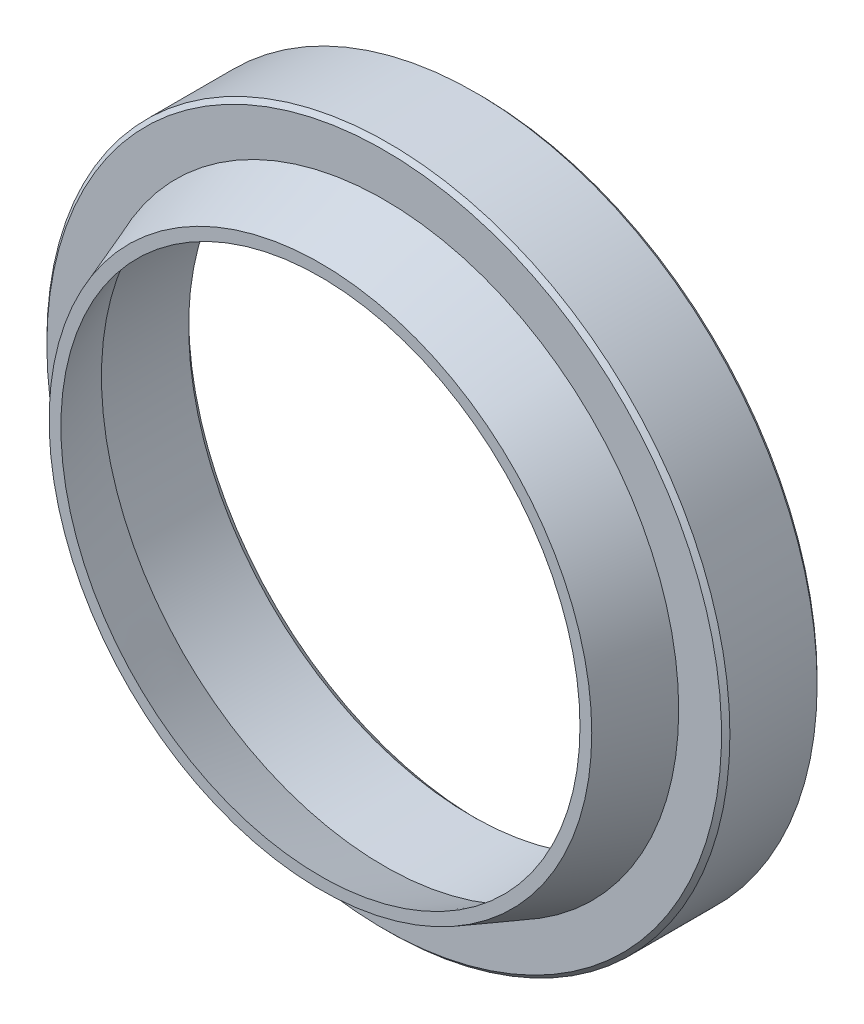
SolidWorks part; units mm, degrees
ref_plane "Front" through (0, 0, 0) normal (0, 0, 1) x (1, 0, 0)
ref_plane "Top" through (0, 0, 0) normal (0, 1, 0) x (1, 0, 0)
ref_plane "Right" through (0, 0, 0) normal (1, 0, 0) x (0, 0, -1)
sketch "Sketch1" plane through (25, 0, -4.5162) normal (0, 1, 0) x (-1, 0, 0)
  line L0 (25, 9.1959) -> (25, -4.6797) construction
  line L1 (45.7, -7.1505) -> (45.7, -0.1545)
  line L2 (45.7, -7.1505) -> (50, -7.1505)
  line L3 (45.7, -0.1545) -> (44, 4.5162)
  line L4 (46.56, -0.1505) -> (50, -0.1505)
  line L5 (50, -7.1505) -> (50, -0.1505)
  line L6 (44, 4.5162) -> (44.8615, 4.5162)
  line L7 (44.8615, 4.5162) -> (46.56, -0.1505)
  dimension "D1" = 38
  dimension "h" = 7
  dimension "D" = 50
  dimension "S" = 4.3
  dimension "D5" = 160
  dimension "D6" = 0.86
  dimension "D7" = 4.6667
revolve "Body" add sketch "Sketch1" angle 360 about L0
chamfer "EndChamfer" distance 0.6143 angle 45 1 edges at (20.7, 0, -11.6667)
chamfer "BodyChamfer" distance 0.3071 angle 45 2 edges at (25, 0, -4.6667) (25, 0, -11.6667)
equation "\"D7@Sketch1\" = 2*\"h@Sketch1\" / 3"
equation "\"D6@Sketch1\" = \"S@Sketch1\" / 5"
equation "\"D1@EndChamfer\" = \"S@Sketch1\" / 7"
equation "\"D1@BodyChamfer\" = \"S@Sketch1\" / 14"
